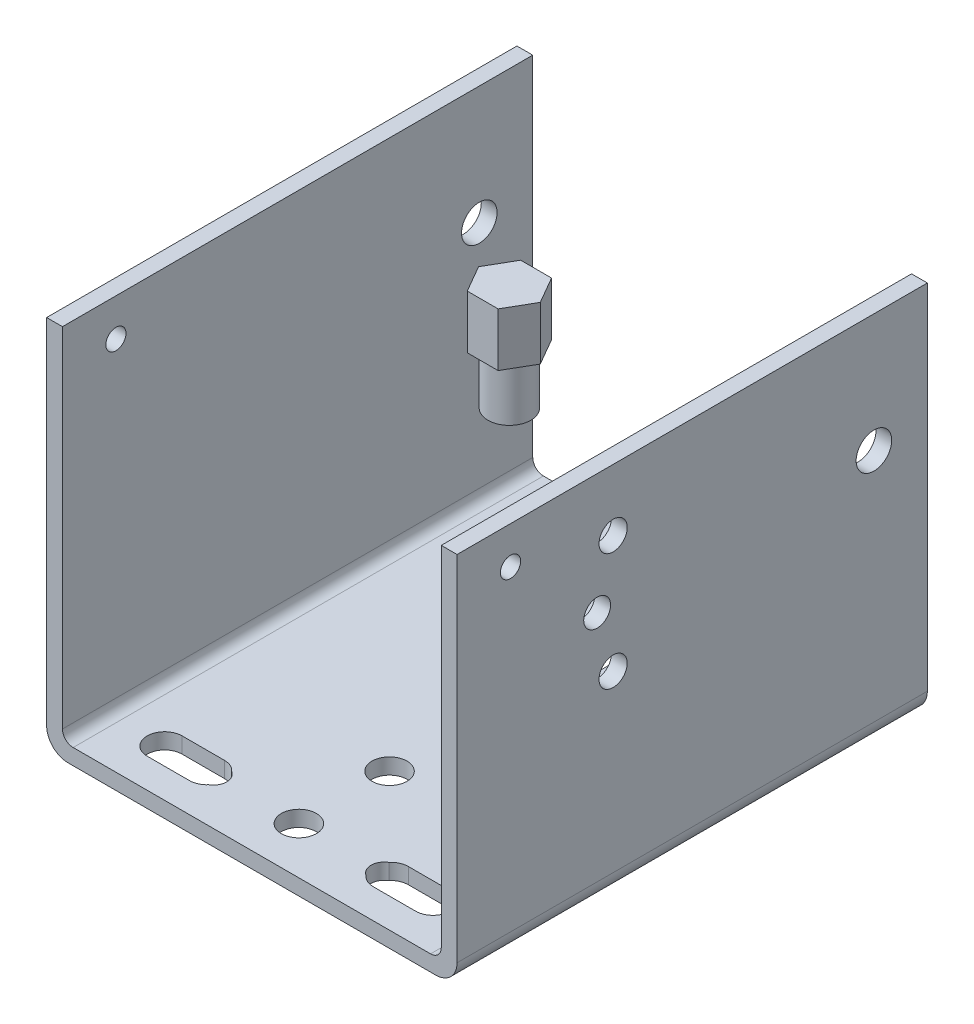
SolidWorks part; units mm, degrees
ref_plane "Front Plane" through (0, 0, 0) normal (0, 0, 1) x (1, 0, 0)
ref_plane "Top Plane" through (0, 0, 0) normal (0, 1, 0) x (1, 0, 0)
ref_plane "Right Plane" through (0, 0, 0) normal (1, 0, 0) x (0, 0, -1)
sketch "Sketch1" plane through (0, 0, 0) normal (0, 0, 1) x (1, 0, 0)
  line L0 (0, 0) -> (0, 84.9662) construction
  line L1 (0, 0) -> (60.96, 0)
  line L2 (60.96, 0) -> (60.96, 111.379)
  line L3 (60.96, 111.379) -> (56.261, 111.379)
  line L4 (56.261, 111.379) -> (56.261, 4.699)
  line L5 (56.261, 4.699) -> (-56.261, 4.699)
  line L6 (-56.261, 4.699) -> (-56.261, 111.379)
  line L7 (-56.261, 111.379) -> (-60.96, 111.379)
  line L8 (-60.96, 111.379) -> (-60.96, 0)
  line L9 (-60.96, 0) -> (0, 0)
  dimension "D1" = 4.699
  dimension "D2" = 4.699
  dimension "D3" = 111.379
  dimension "D4" = 121.92
extrude "Boss-Extrude1" add sketch "Sketch1" along normal blind 139.7
fillet "Fillet1" radius 3.175 2 edges at (56.261, 4.699, 69.85) (-56.261, 4.699, 69.85)
fillet "Fillet2" radius 6.35 2 edges at (-60.96, 0, 69.85) (60.96, 0, 69.85)
sketch "Sk-side" plane through (0, 0, 0) normal (1, 0, 0) x (0, 0, -1)
  line L0 (-139.7, 6.35) -> (-139.7, 111.379) construction
  line L1 (-139.7, 111.379) -> (0, 111.379) construction
  circle A0 centre (-15.875, 76.2) radius 5.2832
  circle A1 centre (-123.825, 100.2538) radius 2.9972
  circle A2 centre (-93.345, 93.0656) radius 4.191
  circle A3 centre (-93.345, 58.166) radius 4.191
  circle A4 centre (-98.0948, 75.6158) radius 3.9878
  dimension "D2" = 10.5664
  dimension "D6" = 5.9944
  dimension "D7" = 8.382
  dimension "D14" = 7.9756
  dimension "D1" = 76.2
  dimension "D3" = 15.875
  dimension "D4" = 15.875
  dimension "D5" = 11.1252
  dimension "D8" = 93.345
  dimension "D9" = 58.166
  dimension "D10" = 34.8996
  dimension "D11" = 18.3134
  dimension "D12" = 18.3134
  dimension "D13" = 17.4498
  dimension "D15" = 4.7498
sketch "Sketch4" plane through (0, 0, 0) normal (1, 0, 0) x (0, 0, -1)
  circle A0 centre (-15.875, 76.2) radius 5.2832 construction
  circle A1 centre (-123.825, 100.2538) radius 2.9972 construction
  circle A2 centre (-15.875, 76.2) radius 5.2832
  circle A3 centre (-123.825, 100.2538) radius 2.9972
extrude "Cut-Extrude1" cut sketch "Sketch4" against normal mid plane 152.4
sketch "Sketch5" plane through (0, 0, 0) normal (1, 0, 0) x (0, 0, -1)
  circle A0 centre (-93.345, 58.166) radius 4.191 construction
  circle A1 centre (-93.345, 93.0656) radius 4.191 construction
  circle A2 centre (-93.345, 58.166) radius 4.191
  circle A3 centre (-93.345, 93.0656) radius 4.191
  circle A4 centre (-98.0948, 75.6158) radius 3.9878 construction
  circle A5 centre (-98.0948, 75.6158) radius 3.9878
extrude "Cut-Extrude2" cut sketch "Sketch5" along normal blind 101.6
sketch "Sk-Top" plane through (0, 0, 0) normal (0, 1, 0) x (1, 0, 0)
  line L0 (0, 0) -> (0, 52.969) construction
  line L1 (0, -15.875) -> (0, -46.355) construction
  line L2 (5.334, -15.875) -> (5.334, -46.355)
  line L3 (-5.334, -15.875) -> (-5.334, -46.355)
  line L4 (53.086, -139.7) -> (-53.086, -139.7) construction
  line L5 (-39.878, -125.73) -> (-27.305, -125.73) construction
  line L6 (-39.878, -120.523) -> (-27.305, -120.523)
  line L7 (-39.878, -130.937) -> (-27.305, -130.937)
  line L8 (27.305, -125.73) -> (39.878, -125.73) construction
  line L9 (27.305, -120.523) -> (39.878, -120.523)
  line L10 (27.305, -130.937) -> (39.878, -130.937)
  line L11 (-61.2585, 0) -> (61.2585, 0) construction
  line L12 (53.086, 0) -> (-53.086, 0) construction
  line L13 (35.3675, -101.9175) -> (39.9502, -93.98)
  line L14 (39.9502, -93.98) -> (35.3675, -86.0425)
  line L15 (35.3675, -86.0425) -> (26.2021, -86.0425)
  line L16 (26.2021, -86.0425) -> (21.6194, -93.98)
  line L17 (21.6194, -93.98) -> (26.2021, -101.9175)
  line L18 (26.2021, -101.9175) -> (35.3675, -101.9175)
  line L19 (60.96, -139.7) -> (60.96, 0) construction
  arc A0 (5.334, -15.875) -> (-5.334, -15.875) centre (0, -15.875) ccw
  arc A1 (-5.334, -46.355) -> (5.334, -46.355) centre (0, -46.355) ccw
  circle A2 centre (0, -98.806) radius 5.207
  circle A3 centre (0, -125.73) radius 5.207
  arc A4 (-39.878, -120.523) -> (-39.878, -130.937) centre (-39.878, -125.73) ccw
  arc A5 (-27.305, -130.937) -> (-27.305, -120.523) centre (-27.305, -125.73) ccw
  arc A6 (27.305, -120.523) -> (27.305, -130.937) centre (27.305, -125.73) ccw
  arc A7 (39.878, -130.937) -> (39.878, -120.523) centre (39.878, -125.73) ccw
  circle A8 centre (25.4, -125.73) radius 3.9624
  circle A9 centre (-25.4, -125.73) radius 3.9624
  circle A10 centre (-25.4, -14.605) radius 3.9624
  circle A11 centre (30.7848, -93.98) radius 7.9375 construction
  circle A12 centre (30.7848, -93.98) radius 6.35
  point P5 (0, -31.115)
  point P18 (-33.5915, -125.73)
  point P23 (33.5915, -125.73)
  dimension "D4" = 10.414
  dimension "D8" = 13.97
  dimension "D11" = 7.9248
  dimension "D18" = 12.7
  dimension "D1" = 10.668
  dimension "D2" = 15.875
  dimension "D3" = 30.48
  dimension "D5" = 26.924
  dimension "D6" = 13.97
  dimension "D7" = 12.573
  dimension "D9" = 10.414
  dimension "D10" = 54.61
  dimension "D12" = 50.8
  dimension "D13" = 111.125
  dimension "D14" = 14.605
  dimension "D15" = 93.98
  dimension "D16" = 15.875
  dimension "D17" = 30.1752
sketch "Sketch7" plane through (0, 0, 0) normal (0, 1, 0) x (1, 0, 0)
  line L0 (-39.878, -130.937) -> (-27.305, -130.937) construction
  line L1 (-39.878, -120.523) -> (-27.305, -120.523) construction
  line L2 (27.305, -130.937) -> (39.878, -130.937) construction
  line L3 (27.305, -120.523) -> (39.878, -120.523) construction
  line L4 (5.334, -15.875) -> (5.334, -46.355) construction
  line L5 (-5.334, -15.875) -> (-5.334, -46.355) construction
  line L6 (-39.878, -130.937) -> (-27.305, -130.937)
  line L7 (-39.878, -120.523) -> (-27.305, -120.523)
  line L8 (27.305, -130.937) -> (39.878, -130.937)
  line L9 (27.305, -120.523) -> (39.878, -120.523)
  line L10 (5.334, -15.875) -> (5.334, -46.355)
  line L11 (-5.334, -15.875) -> (-5.334, -46.355)
  arc A0 (-27.305, -130.937) -> (-27.305, -120.523) centre (-27.305, -125.73) ccw construction
  arc A1 (-39.878, -120.523) -> (-39.878, -130.937) centre (-39.878, -125.73) ccw construction
  arc A2 (39.878, -130.937) -> (39.878, -120.523) centre (39.878, -125.73) ccw construction
  arc A3 (27.305, -120.523) -> (27.305, -130.937) centre (27.305, -125.73) ccw construction
  circle A4 centre (0, -125.73) radius 5.207 construction
  circle A5 centre (0, -98.806) radius 5.207 construction
  arc A6 (-5.334, -46.355) -> (5.334, -46.355) centre (0, -46.355) ccw construction
  arc A7 (5.334, -15.875) -> (-5.334, -15.875) centre (0, -15.875) ccw construction
  arc A8 (-27.305, -130.937) -> (-27.305, -120.523) centre (-27.305, -125.73) ccw
  arc A9 (-39.878, -120.523) -> (-39.878, -130.937) centre (-39.878, -125.73) ccw
  arc A10 (39.878, -130.937) -> (39.878, -120.523) centre (39.878, -125.73) ccw
  arc A11 (27.305, -120.523) -> (27.305, -130.937) centre (27.305, -125.73) ccw
  circle A12 centre (0, -125.73) radius 5.207
  circle A13 centre (0, -98.806) radius 5.207
  arc A14 (-5.334, -46.355) -> (5.334, -46.355) centre (0, -46.355) ccw
  arc A15 (5.334, -15.875) -> (-5.334, -15.875) centre (0, -15.875) ccw
extrude "Cut-Extrude3" cut sketch "Sketch7" along normal blind 25.4
sketch "Sketch8" plane through (0, 0, 0) normal (0, 1, 0) x (1, 0, 0)
  circle A0 centre (-25.4, -125.73) radius 3.9624 construction
  circle A1 centre (25.4, -125.73) radius 3.9624 construction
  circle A2 centre (-25.4, -14.605) radius 3.9624 construction
  circle A3 centre (-25.4, -125.73) radius 3.9624
  circle A4 centre (25.4, -125.73) radius 3.9624
  circle A5 centre (-25.4, -14.605) radius 3.9624
extrude "Cut-Extrude4" cut sketch "Sketch8" along normal blind 25.4
sketch "Sketch9" plane through (0, 0, 0) normal (0, 1, 0) x (1, 0, 0)
  line L0 (26.2021, -101.9175) -> (35.3675, -101.9175) construction
  line L1 (35.3675, -101.9175) -> (39.9502, -93.98) construction
  line L2 (39.9502, -93.98) -> (35.3675, -86.0425) construction
  line L3 (35.3675, -86.0425) -> (26.2021, -86.0425) construction
  line L4 (26.2021, -86.0425) -> (21.6194, -93.98) construction
  line L5 (21.6194, -93.98) -> (26.2021, -101.9175) construction
  line L6 (26.2021, -101.9175) -> (35.3675, -101.9175)
  line L7 (35.3675, -101.9175) -> (39.9502, -93.98)
  line L8 (39.9502, -93.98) -> (35.3675, -86.0425)
  line L9 (35.3675, -86.0425) -> (26.2021, -86.0425)
  line L10 (26.2021, -86.0425) -> (21.6194, -93.98)
  line L11 (21.6194, -93.98) -> (26.2021, -101.9175)
extrude "Boss-Extrude2" add sketch "Sketch9" along normal blind 15.875 from offset 127 separate body
sketch "Sketch10" plane through (0, 0, 0) normal (0, 1, 0) x (1, 0, 0)
  circle A0 centre (30.7848, -93.98) radius 6.35 construction
  circle A1 centre (30.7848, -93.98) radius 6.35
extrude "Boss-Extrude3" add sketch "Sketch10" against normal blind 15.875 from surface at 127
